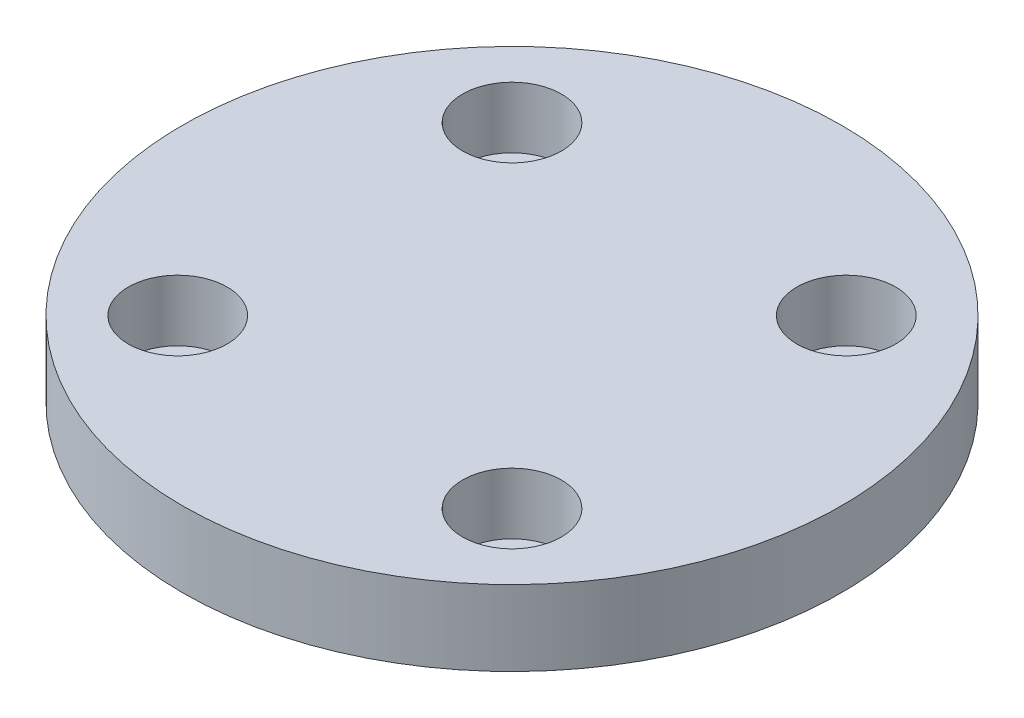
SolidWorks part; units mm, degrees
ref_plane "Front Plane" through (0, 0, 0) normal (0, 0, 1) x (1, 0, 0)
ref_plane "Top Plane" through (0, 0, 0) normal (0, 1, 0) x (1, 0, 0)
ref_plane "Right Plane" through (0, 0, 0) normal (1, 0, 0) x (0, 0, -1)
sketch "Sketch1" plane through (0, 0, 0) normal (0, 1, 0) x (1, 0, 0)
  circle A0 centre (0, 0) radius 35
  dimension "D1" = 70
extrude "Boss-Extrude1" add sketch "Sketch1" along normal blind 8
sketch "Sketch2" plane through (0, 8, 0) normal (0, 1, 0) x (1, 0, 0)
  circle A0 centre (-17.75, 17.75) radius 5.25
  circle A1 centre (17.75, 17.75) radius 5.25
  circle A2 centre (17.75, -17.75) radius 5.25
  circle A3 centre (-17.75, -17.75) radius 5.25
extrude "Cut-Extrude1" cut sketch "Sketch2" against normal blind 6.5
sketch "Sketch3" plane through (0, 1.5, 0) normal (0, 1, 0) x (1, 0, 0)
  circle A0 centre (17.75, 17.75) radius 3.25
  circle A1 centre (-17.75, 17.75) radius 3.25
  circle A2 centre (-17.75, -17.75) radius 3.25
  circle A3 centre (17.75, -17.75) radius 3.25
  dimension "D1" = 6.5
extrude "Cut-Extrude2" cut sketch "Sketch3" against normal blind 2
equation "\"D5@Sketch2\"=\"D4@Sketch2\"/2"
equation "\"D9@Sketch2\"=\"D8@Sketch2\"/2"
equation "\"D3@Sketch2\"=\"D2@Sketch2\"/2"
equation "\"D7@Sketch2\"=\"D6@Sketch2\"/2"
